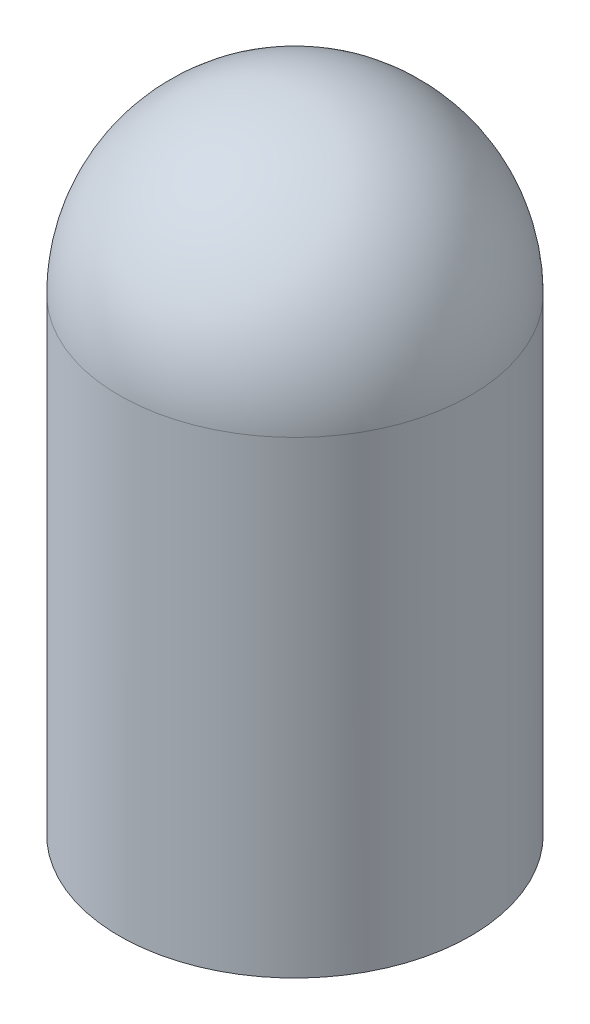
SolidWorks part; units mm, degrees
ref_plane "Face" through (0, 0, 0) normal (0, 0, 1) x (1, 0, 0)
ref_plane "Dessus" through (0, 0, 0) normal (0, 1, 0) x (1, 0, 0)
ref_plane "Droite" through (0, 0, 0) normal (1, 0, 0) x (0, 0, -1)
sketch "Esquisse1" plane through (0, 0, 0) normal (0, 0, 1) x (1, 0, 0)
  line L0 (0, 0) -> (0, 38.753) construction
  line L1 (1.5, 0) -> (1.5, 4)
  arc A0 (1.5, 4) -> (0, 5.5) centre (0, 4) ccw
  dimension "D1" = 1.5
  dimension "D2" = 4
revolve "Base-Révol.-Mince" add sketch "Esquisse1" angle 360 about L0
